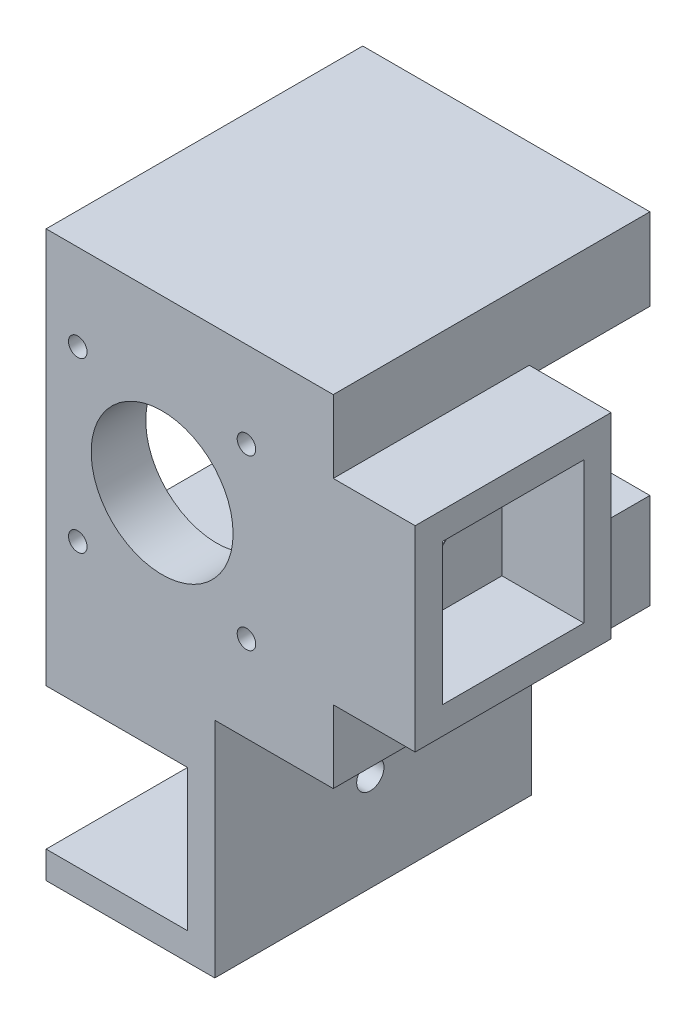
SolidWorks part; units mm, degrees
ref_plane "Front Plane" through (0, 0, 0) normal (0, 0, 1) x (1, 0, 0)
ref_plane "Top Plane" through (0, 0, 0) normal (0, 1, 0) x (1, 0, 0)
ref_plane "Right Plane" through (0, 0, 0) normal (1, 0, 0) x (0, 0, -1)
sketch "Sketch2" plane through (0, 0, 0) normal (0, 0, 1) x (1, 0, 0)
  line L1 (-21.25, -21.25) -> (21.25, -21.25)
  line L2 (-21.25, -21.25) -> (-21.25, 21.25)
  line L3 (-21.25, 21.25) -> (21.25, 21.25)
  line L4 (21.25, -21.25) -> (21.25, 21.25)
  line L5 (-21.25, -21.25) -> (21.25, 21.25) construction
  line L6 (-21.25, 21.25) -> (21.25, -21.25) construction
  line L7 (-31.25, -31.25) -> (31.25, -31.25)
  line L8 (-31.25, -31.25) -> (-31.25, 31.25)
  line L9 (-31.25, 31.25) -> (31.25, 31.25)
  line L10 (31.25, -31.25) -> (31.25, 31.25)
  line L11 (-31.25, -31.25) -> (31.25, 31.25) construction
  line L12 (-31.25, 31.25) -> (31.25, -31.25) construction
  point P0 (0, 0)
  point P6 (0, 0)
  dimension "D1" = 42.5
  dimension "D2" = 42.5
  dimension "D3" = 10
  dimension "D4" = 10
extrude "Boss-Extrude2" add sketch "Sketch2" against normal blind 48
sketch "Sketch3" plane through (0, 0, 0) normal (0, 0, 1) x (1, 0, 0)
  line L0 (31.25, -31.25) -> (31.25, 31.25) construction
  line L1 (-31.25, -31.25) -> (31.25, -31.25)
  line L2 (-31.25, -31.25) -> (-31.25, 31.25)
  line L3 (-31.25, 31.25) -> (31.25, 31.25)
  line L4 (31.25, -31.25) -> (31.25, 31.25)
  line L5 (-31.25, -31.25) -> (31.25, 31.25) construction
  line L6 (-31.25, 31.25) -> (31.25, -31.25) construction
  circle A0 centre (0, 0) radius 13
extrude "Boss-Extrude3" add sketch "Sketch3" along normal blind 10
sketch "Sketch15" plane through (31.25, 0, 0) normal (1, 0, 0) x (0, 0, -1)
  line L0 (19, 31.25) -> (19, -32.891) construction
  line L1 (48, 31.25) -> (-10, 31.25) construction
  line L2 (-10, 0) -> (56.8833, 0) construction
  line L3 (-10, -31.25) -> (-10, 31.25) construction
  line L5 (-10, -31.25) -> (48, -31.25)
  line L6 (-10, -31.25) -> (-10, 31.25)
  line L7 (-10, 31.25) -> (48, 31.25)
  line L8 (48, -31.25) -> (48, 31.25)
  line L9 (-10, -31.25) -> (48, 31.25) construction
  line L10 (-10, 31.25) -> (48, -31.25) construction
  point P9 (19, 0)
extrude "Boss-Extrude8" add sketch "Sketch15" along normal blind 0.1
sketch "Sketch16" plane through (31.35, 0, 0) normal (1, 0, 0) x (0, 0, -1)
  line L0 (19, 31.25) -> (19, 12.95) construction
  line L1 (48, 31.25) -> (-10, 31.25) construction
  line L2 (-10, 0) -> (-5, 0) construction
  line L3 (-10, 31.25) -> (-10, -31.25) construction
  line L5 (-5, -12.95) -> (20.9, -12.95)
  line L6 (-5, -12.95) -> (-5, 12.95)
  line L7 (-5, 12.95) -> (20.9, 12.95)
  line L8 (20.9, -12.95) -> (20.9, 12.95)
  line L11 (-10, -17.95) -> (25.9, -17.95)
  line L12 (-10, -17.95) -> (-10, 17.95)
  line L13 (-10, 17.95) -> (25.9, 17.95)
  line L14 (25.9, -17.95) -> (25.9, 17.95)
  line L17 (19, -12.95) -> (19, -34.4013) construction
  line L19 (20.9, 0) -> (53.4432, 0) construction
  point P9 (19, 0)
  point P14 (19, 0)
  dimension "D1" = 25.9
  dimension "D2" = 25.9
  dimension "D3" = 35.9
  dimension "D4" = 35.9
  dimension "D5" = 0
  dimension "D6" = 5
extrude "Boss-Extrude9" add sketch "Sketch16" along normal blind 20
sketch "Sketch17" plane through (31.35, 0, 0) normal (1, 0, 0) x (0, 0, -1)
  line L0 (7.95, 12.95) -> (7.95, -15.2055) construction
  line L2 (20.9, 12.95) -> (-5, 12.95) construction
  line L4 (-5, 0) -> (31.4158, 0) construction
  line L5 (-5, 12.95) -> (-5, -12.95) construction
  circle A1 centre (7.95, 0) radius 3.43
  dimension "D1" = 6.86
extrude "Cut-Extrude2" cut sketch "Sketch17" against normal blind 10
sketch "Sketch18" plane through (21.25, 0, 0) normal (-1, 0, 0) x (0, 0, 1)
  circle A0 centre (-7.95, 0) radius 7
  dimension "D1" = 14
extrude "Cut-Extrude3" cut sketch "Sketch18" against normal blind 10
sketch "Sketch19" plane through (0, 0, 10) normal (0, 0, 1) x (1, 0, 0)
  line L0 (21.25, 21.25) -> (-21.25, 21.25) construction
  line L1 (-21.25, 21.25) -> (-21.25, -21.25) construction
  line L2 (21.25, -21.25) -> (21.25, 21.25) construction
  line L3 (-21.25, -21.25) -> (21.25, -21.25) construction
  circle A0 centre (-15.45, 15.45) radius 1.7
  circle A1 centre (15.45, 15.45) radius 1.7
  circle A2 centre (15.45, -15.45) radius 1.7
  circle A3 centre (-15.45, -15.45) radius 1.7
  dimension "D1" = 3.4
  dimension "D2" = 3.4
  dimension "D3" = 3.4
  dimension "D4" = 3.4
  dimension "D5" = 5.8
  dimension "D6" = 5.8
  dimension "D7" = 5.8
  dimension "D8" = 5.8
  dimension "D9" = 5.8
  dimension "D10" = 5.8
  dimension "D11" = 5.8
  dimension "D12" = 5.8
extrude "Cut-Extrude4" cut sketch "Sketch19" against normal blind 10
sketch "Sketch20" plane through (0, 31.25, 0) normal (0, 1, 0) x (1, 0, 0)
  line L2 (-31.25, 48) -> (-31.25, -10)
  line L6 (-31.25, 48) -> (9.65, 48)
  line L7 (31.35, 48) -> (-31.25, 48) construction
  line L8 (9.65, 48) -> (9.65, -10)
  line L9 (31.35, -10) -> (-31.25, -10) construction
  line L10 (9.65, -10) -> (-31.25, -10)
  dimension "D1" = 40.9
sketch "Sketch35" plane through (31.35, 0, 0) normal (1, 0, 0) x (0, 0, -1)
  line L1 (25.9, -13.75) -> (48, -13.75)
  line L2 (25.9, -13.75) -> (25.9, 16.25)
  line L3 (25.9, 16.25) -> (48, 16.25)
  line L4 (48, -13.75) -> (48, 16.25)
  line L6 (25.9, -17.95) -> (25.9, 17.95) construction
  line L7 (-10, -31.25) -> (48, -31.25) construction
  line L8 (48, -31.25) -> (48, 31.25) construction
  dimension "D1" = 30
  dimension "D2" = 17.5
extrude "Cut-Extrude11" cut sketch "Sketch35" against normal through all
sketch "Sketch42" plane through (0, 17.95, 0) normal (0, 1, 0) x (1, 0, 0)
  line L0 (51.35, 25.9) -> (51.35, -10)
  line L4 (51.35, -10) -> (46.35, -10)
  line L5 (51.35, -10) -> (31.35, -10) construction
  line L6 (46.35, -10) -> (46.35, 25.9)
  line L7 (51.35, 25.9) -> (31.35, 25.9) construction
  line L8 (46.35, 25.9) -> (51.35, 25.9)
  dimension "D1" = 5
extrude "Cut-Extrude17" cut sketch "Sketch42" against normal through all
sketch "Sketch49" plane through (0, -31.25, 0) normal (0, -1, 0) x (1, 0, 0)
  line L0 (-31.25, 10) -> (31.35, 10) construction
  line L1 (-21.25, -48) -> (9.65, -48)
  line L2 (-21.25, -48) -> (-21.25, 10)
  line L3 (-21.25, 10) -> (9.65, 10)
  line L4 (9.65, -48) -> (9.65, 10)
  dimension "D1" = 30.9
extrude "Boss-Extrude14" add sketch "Sketch49" along normal blind 40.9
sketch "Sketch51" plane through (0, 0, 10) normal (0, 0, 1) x (1, 0, 0)
  line L0 (-21.25, -72.15) -> (-21.25, -31.25) construction
  line L1 (-21.25, -41.25) -> (4.65, -41.25)
  line L2 (-21.25, -41.25) -> (-21.25, -67.15)
  line L3 (-21.25, -67.15) -> (4.65, -67.15)
  line L4 (4.65, -41.25) -> (4.65, -67.15)
  line L5 (9.65, -72.15) -> (-21.25, -72.15) construction
  dimension "D1" = 25.9
  dimension "D2" = 25.9
  dimension "D3" = 5
extrude "Cut-Extrude19" cut sketch "Sketch51" against normal through all
sketch "Sketch52" plane through (0, 0, 10) normal (0, 0, 1) x (1, 0, 0)
  line L1 (-31.25, 31.25) -> (-21.25, 31.25)
  line L2 (-31.25, 31.25) -> (-31.25, -31.25)
  line L3 (-31.25, -31.25) -> (-21.25, -31.25)
  line L4 (-21.25, 31.25) -> (-21.25, -31.25)
extrude "Cut-Extrude20" cut sketch "Sketch52" against normal through all
sketch "Sketch53" plane through (9.65, 0, 0) normal (1, 0, 0) x (0, 0, -1)
  line L0 (18.4932, -41.25) -> (18.4932, -76.7415) construction
  line L1 (48, -41.25) -> (-10, -41.25) construction
  circle A0 centre (18.4932, -54.2) radius 2.5
  dimension "D2" = 5
  dimension "D1" = 12.95
extrude "Cut-Extrude21" cut sketch "Sketch53" against normal through all
sketch "Sketch54" plane through (0, -72.15, 0) normal (0, -1, 0) x (1, 0, 0)
  line L0 (-21.25, -19) -> (12.4203, -19) construction
  line L1 (-21.25, 10) -> (-21.25, -48) construction
  circle A0 centre (-8.3, -19) radius 2.5
  dimension "D2" = 5
  dimension "D1" = 12.95
extrude "Cut-Extrude22" cut sketch "Sketch54" against normal blind 20.9
sketch "Sketch56" plane through (0, 31.25, 0) normal (0, 1, 0) x (1, 0, 0)
  line L1 (7.55, 39) -> (2.55, 39)
  line L2 (7.55, 39) -> (7.55, -1)
  line L3 (7.55, -1) -> (2.55, -1)
  line L4 (2.55, 39) -> (2.55, -1)
  line L5 (31.35, -10) -> (-21.25, -10) construction
  line L7 (-21.25, 48) -> (-21.25, -10) construction
  dimension "D1" = 40
  dimension "D2" = 5
  dimension "D3" = 9
  dimension "D4" = 23.8
